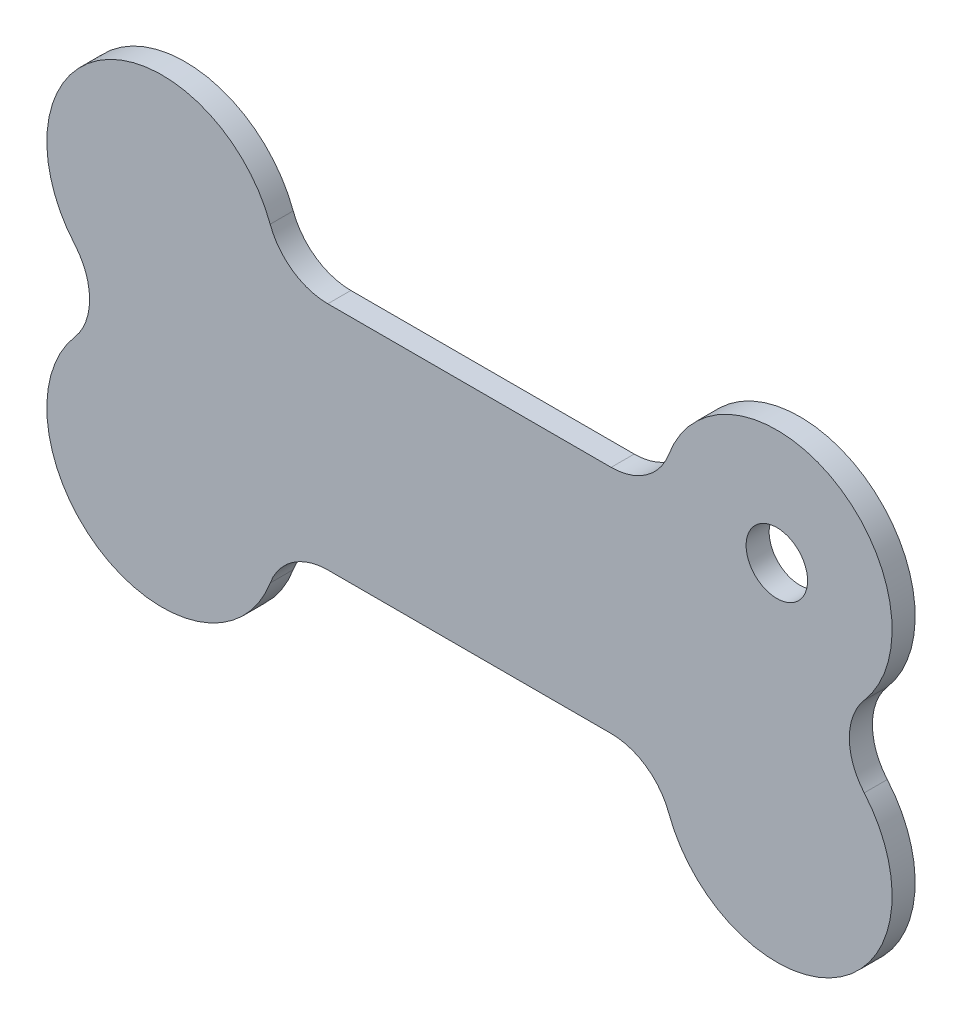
SolidWorks part; units mm, degrees
ref_plane "XY" through (0, 0, 0) normal (0, 0, 1) x (1, 0, 0)
ref_plane "XZ" through (0, 0, 0) normal (0, 1, 0) x (1, 0, 0)
ref_plane "YZ" through (0, 0, 0) normal (1, 0, 0) x (0, 0, -1)
sketch "Esquisse1" plane through (0, 0, 0) normal (0, 0, 1) x (1, 0, 0)
  line L0 (0, 21.0659) -> (0, -24.7616) construction
  line L1 (9.2181, 7.5) -> (-9.2181, 7.5)
  line L2 (-30.6816, 0) -> (29.6357, 0) construction
  line L3 (9.2181, -7.5) -> (-9.2181, -7.5)
  arc A0 (-12.9683, 10.1087) -> (-25.6855, 2.6087) centre (-20, 7.5) ccw
  arc A1 (-9.2181, 7.5) -> (-12.9683, 10.1087) centre (-9.2181, 11.5) cw
  arc A2 (9.2181, 7.5) -> (12.9683, 10.1087) centre (9.2181, 11.5) ccw
  arc A3 (12.9683, 10.1087) -> (25.6855, 2.6087) centre (20, 7.5) cw
  arc A4 (12.9683, -10.1087) -> (25.6855, -2.6087) centre (20, -7.5) ccw
  arc A5 (9.2181, -7.5) -> (12.9683, -10.1087) centre (9.2181, -11.5) cw
  arc A6 (-9.2181, -7.5) -> (-12.9683, -10.1087) centre (-9.2181, -11.5) ccw
  arc A7 (-12.9683, -10.1087) -> (-25.6855, -2.6087) centre (-20, -7.5) cw
  arc A8 (-25.6855, -2.6087) -> (-25.6855, 2.6087) centre (-28.7178, 0) ccw
  arc A9 (25.6855, -2.6087) -> (25.6855, 2.6087) centre (28.7178, 0) cw
  circle A10 centre (20, 7.5) radius 2
  point P10 (-12.5, 7.5)
  point P17 (0, 7.5)
  point P25 (0, -7.5)
  point P28 (-20, 0)
  point P31 (20, 0)
  dimension "D3" = 7.5
  dimension "D1" = 4
  dimension "D2" = 4
  dimension "D6" = 4
  dimension "D4" = 15
  dimension "D5" = 40
extrude "Médaille" add sketch "Esquisse1" along normal blind 1.5
